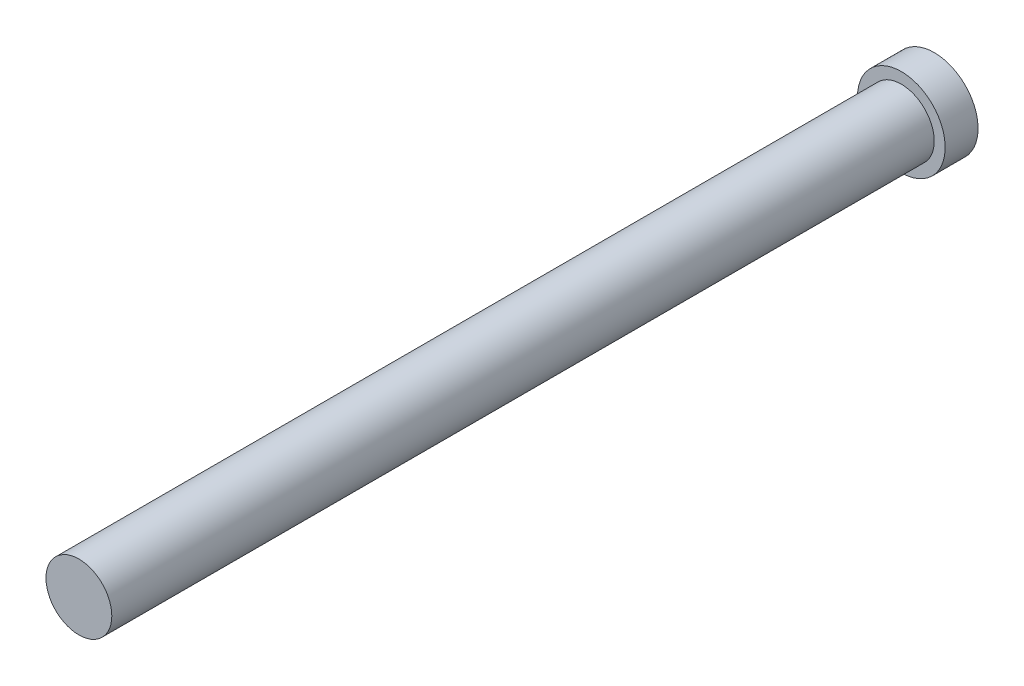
SolidWorks part; units mm, degrees
ref_plane "前视" through (0, 0, 0) normal (0, 0, 1) x (1, 0, 0)
ref_plane "上视" through (0, 0, 0) normal (0, 1, 0) x (1, 0, 0)
ref_plane "右视" through (0, 0, 0) normal (1, 0, 0) x (0, 0, -1)
sketch "草图1" plane through (0, 0, 0) normal (0, 0, 1) x (1, 0, 0)
  circle A0 centre (0, 0) radius 1.5
extrude "凸台-拉伸1" add sketch "草图1" along normal blind 37.5
sketch "草图2" plane through (0, 0, 0) normal (0, 0, -1) x (-1, 0, 0)
  circle A0 centre (0, 0) radius 2
extrude "凸台-拉伸2" add sketch "草图2" along normal blind 1.5
sketch "草图3" plane through (0, 0, -1.5) normal (0, 0, -1) x (-1, 0, 0)
  line L0 (-0.2968, 0.305) -> (-1.7357, 0.305)
  line L1 (1.7357, -0.305) -> (0.2968, -0.305)
  line L2 (1.7357, -0.305) -> (1.7357, 0.305)
  line L3 (1.7357, 0.305) -> (0.2968, 0.305)
  line L4 (-1.7357, -0.305) -> (-1.7357, 0.305)
  line L5 (1.7357, -0.305) -> (-1.7357, 0.305) construction
  line L6 (1.7357, 0.305) -> (-1.7357, -0.305) construction
  line L7 (0.2968, -1.689) -> (-0.2968, -1.689)
  line L8 (0.2968, -1.689) -> (0.2968, -0.305)
  line L9 (0.2968, 1.689) -> (-0.2968, 1.689)
  line L10 (-0.2968, -1.689) -> (-0.2968, -0.305)
  line L11 (0.2968, -1.689) -> (-0.2968, 1.689) construction
  line L12 (0.2968, 1.689) -> (-0.2968, -1.689) construction
  line L13 (-0.2968, 0.305) -> (-0.2968, 1.689)
  line L14 (-0.2968, -0.305) -> (-1.7357, -0.305)
  line L15 (0.2968, 0.305) -> (0.2968, 1.689)
  point P0 (0, 0)
  point P6 (0, 0)
extrude "切除-拉伸1" cut sketch "草图3" against normal blind 1
